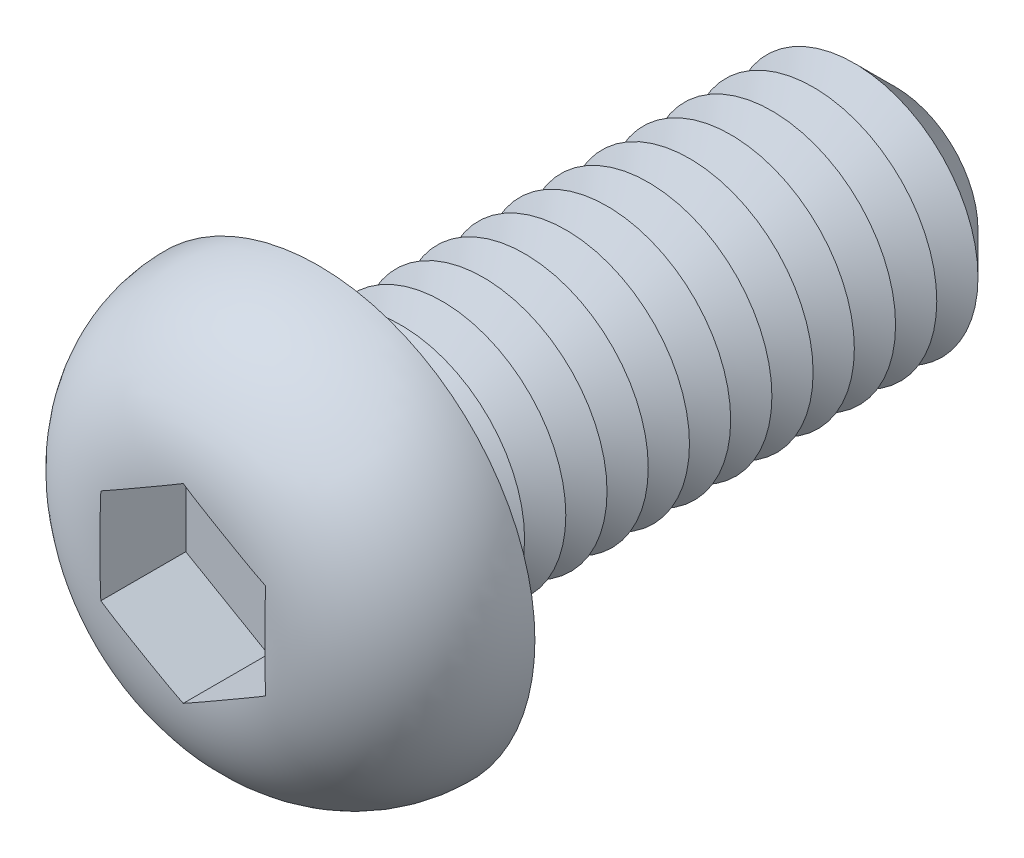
SolidWorks part; units mm, degrees
ref_plane "Front Plane" through (0, 0, 0) normal (0, 0, 1) x (1, 0, 0)
ref_plane "Top Plane" through (0, 0, 0) normal (0, 1, 0) x (1, 0, 0)
ref_plane "Right Plane" through (0, 0, 0) normal (1, 0, 0) x (0, 0, -1)
sketch "Sketch1" plane through (0, 0, 0) normal (1, 0, 0) x (0, 0, -1)
  line L0 (-47.9342, 0) -> (60.3146, 0) construction
sketch "Sketch2" plane through (0, 0, 0) normal (1, 0, 0) x (0, 0, -1)
  line L0 (0, 0) -> (-3.3, 0)
  line L1 (-47.9342, 0) -> (60.3146, 0) construction
  line L2 (-3.3, 0) -> (-3.3, 1.95)
  line L3 (0, 5.25) -> (0, 0)
  arc A0 (-3.3, 1.95) -> (0, 5.25) centre (0, 1.95) cw
  dimension "D1" = 3.3
  dimension "D2" = 3.3
  dimension "D3" = 5.25
revolve "Revolve1" add sketch "Sketch2" angle 360 about L0
sketch "Sketch3" plane through (0, 0, 3.3) normal (0, 0, 1) x (1, 0, 0)
  line L1 (0, 2.3094) -> (-2, 1.1547)
  line L2 (-2, 1.1547) -> (-2, -1.1547)
  line L3 (-2, -1.1547) -> (0, -2.3094)
  line L4 (0, -2.3094) -> (2, -1.1547)
  line L5 (2, -1.1547) -> (2, 1.1547)
  line L6 (2, 1.1547) -> (0, 2.3094)
  circle A0 centre (0, 0) radius 2 construction
  dimension "D1" = 4
extrude "Cut-Extrude1" cut sketch "Sketch3" against normal blind 2.08
sketch "Sketch4" plane through (0, 0, 0) normal (0, 0, -1) x (-1, 0, 0)
  circle A0 centre (0, 0) radius 3
  dimension "D1" = 6
extrude "Boss-Extrude1" add sketch "Sketch4" along normal blind 14
chamfer "Chamfer1" distance 1 angle 45 1 edges at (-3, 0, -14)
sketch "Sketch5" plane through (0, 0, 0) normal (1, 0, 0) x (0, 0, -1)
  line L0 (1, 3) -> (2, 3)
  line L1 (13, 3) -> (0, 3) construction
  line L2 (2, 3) -> (1.5, 2.134)
  line L3 (1.5, 2.134) -> (1, 3)
  line L4 (0, -5.25) -> (0, 5.25) construction
  line L5 (13, 3) -> (0, 3) construction
  dimension "D1" = 1
  dimension "D2" = 1
revolve "Cut-Revolve1" cut sketch "Sketch5" angle 360 about L0
pattern_linear "LPattern1" count 12 spacing 1 along (0, 0, -1) of "Cut-Revolve1"
fillet "Fillet2" radius 0.5 1 edges at (3, 0, 0)
sketch "Sketch6" plane through (0, 0, 1.22) normal (0, 0, 1) x (1, 0, 0)
  circle A0 centre (0, 0) radius 0.8
  dimension "D1" = 1.6
extrude "Cut-Extrude2" cut sketch "Sketch6" against normal up to surface (15.22 mm away)
